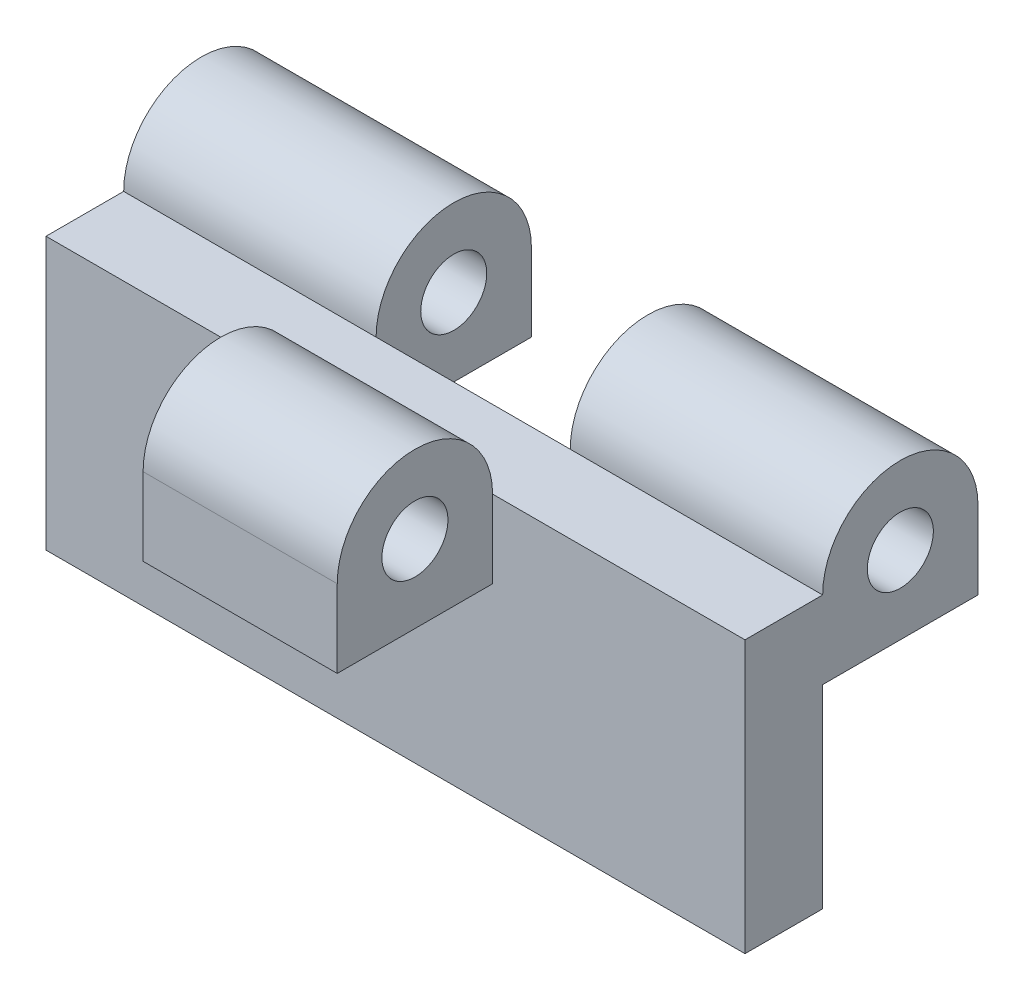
SolidWorks part; units mm, degrees
ref_plane "Front Plane" through (0, 0, 0) normal (0, 0, 1) x (1, 0, 0)
ref_plane "Top Plane" through (0, 0, 0) normal (0, 1, 0) x (1, 0, 0)
ref_plane "Right Plane" through (0, 0, 0) normal (1, 0, 0) x (0, 0, -1)
sketch "Sketch1" plane through (0, 0, 0) normal (0, 1, 0) x (1, 0, 0)
  line L1 (-26.4866, 6) -> (-8.4866, 6)
  line L2 (-26.4866, 6) -> (-26.4866, -4)
  line L3 (-26.4866, -4) -> (-8.4866, -4)
  line L4 (-8.4866, 6) -> (-8.4866, -4)
  dimension "D1" = 18
  dimension "D2" = 10
extrude "Boss-Extrude1" add sketch "Sketch1" along normal blind 4
sketch "Sketch3" plane through (0, 4, 0) normal (0, 1, 0) x (1, 0, 0)
  line L0 (-26.4866, 6) -> (-19.9866, 6) construction
  line L1 (-8.4866, 6) -> (-26.4866, 6) construction
  line L2 (-8.4866, 6) -> (-14.9866, 6) construction
  line L4 (-19.9866, 6) -> (-14.9866, 6)
  line L5 (-19.9866, 6) -> (-19.9866, 2)
  line L6 (-19.9866, 2) -> (-14.9866, 2)
  line L7 (-14.9866, 6) -> (-14.9866, 2)
  dimension "D1" = 6.5
  dimension "D2" = 6.5
  dimension "D3" = 4
extrude "Cut-Extrude1" cut sketch "Sketch3" against normal blind 4
sketch "Sketch4" plane through (0, 4, 0) normal (0, 1, 0) x (1, 0, 0)
  line L1 (-26.4866, -4) -> (-19.9866, -4)
  line L2 (-26.4866, -4) -> (-26.4866, 0)
  line L3 (-26.4866, 0) -> (-19.9866, 0)
  line L4 (-19.9866, -4) -> (-19.9866, 0)
  line L5 (-8.4866, -4) -> (-14.9866, -4)
  line L6 (-8.4866, -4) -> (-8.4866, 0)
  line L7 (-8.4866, 0) -> (-14.9866, 0)
  line L8 (-14.9866, -4) -> (-14.9866, 0)
  dimension "D1" = 4
  dimension "D2" = 4
extrude "Cut-Extrude2" cut sketch "Sketch4" against normal blind 4
sketch "Sketch7" plane through (-19.9866, 0, 0) normal (-1, 0, 0) x (0, 0, 1)
  line L0 (4, 0) -> (0, 4) construction
  line L1 (4, 4) -> (0, 4) construction
  line L2 (4, 0) -> (4, 4) construction
  line L3 (0, 0) -> (0, 4) construction
  circle A0 centre (2, 2) radius 0.85
  arc A1 (4, 2) -> (0, 2) centre (2, 2) ccw
  dimension "D1" = 1.7
extrude "Cut-Extrude6" cut sketch "Sketch7" against normal blind 20 contours L0 A1 M1 | A1 L0 M2 | A1 M4 M1 | A0 L0 | L0 A0
sketch "Sketch10" plane through (-26.4866, 0, 0) normal (-1, 0, 0) x (0, 0, 1)
  line L0 (-6, 4) -> (-2, 4) construction
  line L1 (-6, 4) -> (0, 4) construction
  line L2 (-4, 4) -> (-4, 2) construction
  line L3 (-2, 4) -> (-2, 0) construction
  line L4 (-6, 0) -> (0, 0) construction
  line L5 (-6, 4) -> (-6, 0) construction
  line L6 (-2, 2) -> (-2, 4)
  line L7 (-2, 4) -> (-6, 4)
  line L8 (-6, 4) -> (-6, 2)
  circle A0 centre (-4, 2) radius 0.85
  arc A1 (-6, 2) -> (-2, 2) centre (-4, 2) cw
  dimension "D3" = 1.7
  dimension "D2" = 2
extrude "Cut-Extrude9" cut sketch "Sketch10" against normal blind 20 contours A1 L7 M6 | A1 L6 M5 | A0
sketch "Sketch11" plane through (-26.4866, 0, 0) normal (-1, 0, 0) x (0, 0, 1)
  line L0 (-2, 2) -> (0, 2)
  line L1 (0, 0) -> (0, 4) construction
  line L2 (0, 2) -> (0, 4)
  line L3 (0, 4) -> (-2, 4)
  line L4 (-2, 4) -> (-2, 2)
extrude "Cut-Extrude10" cut sketch "Sketch11" against normal blind 20
sketch "Sketch12" plane through (0, 0, 0) normal (0, -1, 0) x (1, 0, 0)
  line L0 (-8.4866, 0) -> (-26.4866, 0)
  line L1 (-8.4866, -2) -> (-26.4866, -2)
  line L3 (-26.4866, -6) -> (-26.4866, 0) construction
  line L4 (-8.4866, -2) -> (-8.4866, 0)
  line L5 (-26.4866, -2) -> (-26.4866, 0)
  point P11 (-17.4866, -2)
extrude "Boss-Extrude2" add sketch "Sketch12" along normal blind 5
